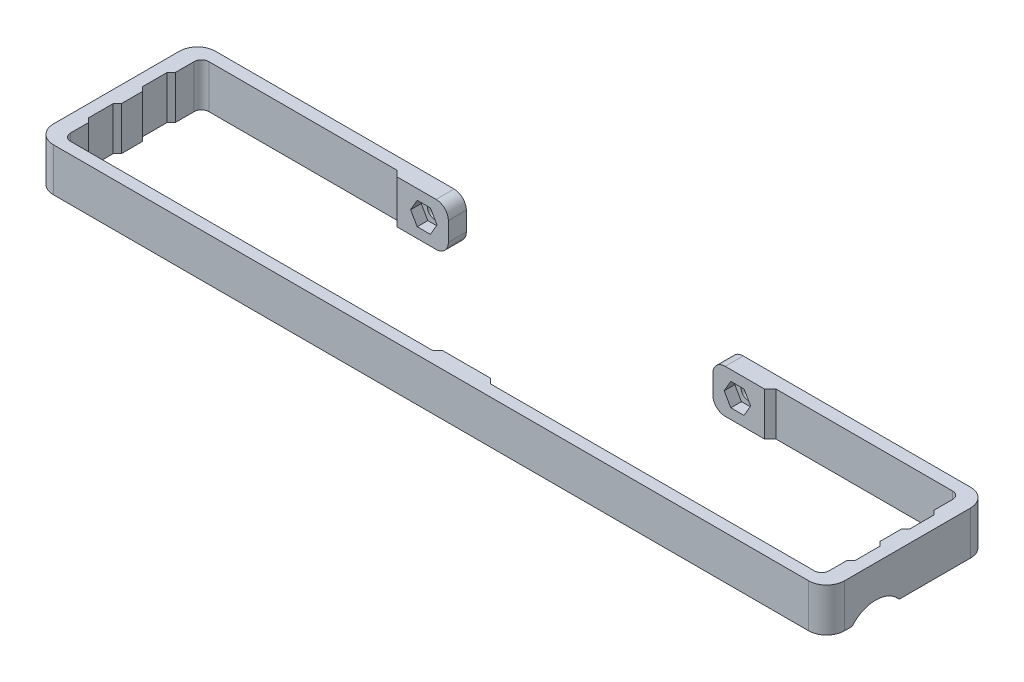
SolidWorks part; units mm, degrees
ref_plane "Front Plane" through (0, 0, 0) normal (0, 0, 1) x (1, 0, 0)
ref_plane "Top Plane" through (0, 0, 0) normal (0, 1, 0) x (1, 0, 0)
ref_plane "Right Plane" through (0, 0, 0) normal (1, 0, 0) x (0, 0, -1)
sketch "Sketch1" plane through (0, 0, 0) normal (0, 0, 1) x (1, 0, 0)
  line L1 (-72.0026, 47.8166) -> (121.3974, 47.8166)
  line L2 (-72.0026, 47.8166) -> (-72.0026, 37.2166)
  line L3 (-72.0026, 37.2166) -> (121.3974, 37.2166)
  line L4 (121.3974, 47.8166) -> (121.3974, 37.2166)
  dimension "D1" = 193.4
  dimension "D2" = 10.6
extrude "Boss-Extrude1" add sketch "Sketch1" along normal blind 4
ref_plane "Plane1" through (0, 0, 0) normal (0, 0, -1) x (-1, 0, 0)
sketch "Sketch2" plane through (0, 0, 0) normal (0, 0, -1) x (-1, 0, 0)
  line L0 (-121.3974, 47.8166) -> (72.0026, 47.8166) construction
  line L1 (-121.3974, 37.2166) -> (-117.3974, 37.2166)
  line L2 (-121.3974, 37.2166) -> (-121.3974, 47.8166)
  line L3 (-121.3974, 47.8166) -> (-117.3974, 47.8166)
  line L4 (-117.3974, 37.2166) -> (-117.3974, 47.8166)
  line L6 (72.0026, 37.2166) -> (68.0026, 37.2166)
  line L7 (72.0026, 37.2166) -> (72.0026, 47.8166)
  line L8 (72.0026, 47.8166) -> (68.0026, 47.8166)
  line L9 (68.0026, 37.2166) -> (68.0026, 47.8166)
  dimension "D1" = 4
  dimension "D2" = 4
extrude "Boss-Extrude2" add sketch "Sketch2" along normal blind 35.6
ref_plane "Plane2" through (0, 47.8166, 0) normal (0, 1, 0) x (1, 0, 0)
sketch "Sketch3" plane through (0, 47.8166, 0) normal (0, 1, 0) x (1, 0, 0)
  line L1 (-68.0026, 35.6) -> (-6.2626, 35.6)
  line L2 (-68.0026, 35.6) -> (-68.0026, 31.2)
  line L3 (-68.0026, 31.2) -> (-6.2626, 31.2)
  line L4 (-6.2626, 35.6) -> (-6.2626, 31.2)
  line L5 (117.3974, 35.6) -> (58.3974, 35.6)
  line L6 (117.3974, 35.6) -> (117.3974, 31.2)
  line L7 (117.3974, 31.2) -> (58.3974, 31.2)
  line L8 (58.3974, 35.6) -> (58.3974, 31.2)
  dimension "D1" = 4.4
  dimension "D2" = 4.4
  dimension "D3" = 61.74
  dimension "D4" = 59
extrude "Boss-Extrude3" add sketch "Sketch3" against normal blind 10.6
fillet "Fillet1" radius 4.4 4 edges at (121.3974, 42.5166, -35.6) (-72.0026, 42.5166, -35.6) (-72.0026, 42.5166, 4) (121.3974, 42.5166, 4)
ref_plane "Plane3" through (0, 0, -35.6) normal (0, 0, -1) x (-1, 0, 0)
sketch "Sketch4" plane through (0, 0, -35.6) normal (0, 0, -1) x (-1, 0, 0)
  line L0 (6.2626, 37.2166) -> (6.2626, 47.8166) construction
  line L1 (67.6026, 47.8166) -> (6.2626, 47.8166) construction
  line L2 (-58.3974, 47.8166) -> (-116.9974, 47.8166) construction
  line L3 (-58.3974, 37.2166) -> (-58.3974, 47.8166) construction
  circle A0 centre (12.2626, 42.5166) radius 1.7
  circle A1 centre (-64.3974, 42.5166) radius 1.7
  dimension "D1" = 3.4
  dimension "D2" = 3.4
  dimension "D3" = 6
  dimension "D4" = 5.3
  dimension "D5" = 5.3
  dimension "D6" = 6
extrude "Cut-Extrude1" cut sketch "Sketch4" against normal blind 10.6
ref_plane "Plane4" through (0, 0, -31.2) normal (0, 0, 1) x (1, 0, 0)
sketch "Sketch5" plane through (0, 0, -31.2) normal (0, 0, 1) x (1, 0, 0)
  line L1 (-10.646, 39.7166) -> (-9.0295, 42.5166)
  line L2 (-9.0295, 42.5166) -> (-10.646, 45.3166)
  line L3 (-10.646, 45.3166) -> (-13.8792, 45.3166)
  line L4 (-13.8792, 45.3166) -> (-15.4958, 42.5166)
  line L5 (-15.4958, 42.5166) -> (-13.8792, 39.7166)
  line L6 (-13.8792, 39.7166) -> (-10.646, 39.7166)
  line L7 (66.014, 39.7166) -> (67.6305, 42.5166)
  line L8 (67.6305, 42.5166) -> (66.014, 45.3166)
  line L9 (66.014, 45.3166) -> (62.7808, 45.3166)
  line L10 (62.7808, 45.3166) -> (61.1642, 42.5166)
  line L11 (61.1642, 42.5166) -> (62.7808, 39.7166)
  line L12 (62.7808, 39.7166) -> (66.014, 39.7166)
  circle A0 centre (-12.2626, 42.5166) radius 2.8 construction
  circle A1 centre (64.3974, 42.5166) radius 2.8 construction
  dimension "D1" = 5.6
  dimension "D2" = 5.6
extrude "Cut-Extrude2" cut sketch "Sketch5" against normal blind 2.6
sketch "Sketch6" plane through (0, 47.8166, 0) normal (0, 1, 0) x (1, 0, 0)
  line L0 (121.3974, 0.4) -> (121.3974, 31.2) construction
  line L1 (117.3974, 4) -> (118.3974, 4)
  line L2 (117.3974, 4) -> (117.3974, 14)
  line L3 (117.3974, 14) -> (118.3974, 14)
  line L4 (118.3974, 4) -> (118.3974, 14)
  line L5 (117.3974, 27.2) -> (118.3974, 27.2)
  line L6 (117.3974, 27.2) -> (117.3974, 17.2)
  line L7 (117.3974, 17.2) -> (118.3974, 17.2)
  line L8 (118.3974, 27.2) -> (118.3974, 17.2)
  line L9 (117.3974, 31.2) -> (117.3974, 0) construction
  line L10 (-68.0026, 4) -> (-69.0026, 4)
  line L11 (-68.0026, 4) -> (-68.0026, 14)
  line L12 (-68.0026, 14) -> (-69.0026, 14)
  line L13 (-69.0026, 4) -> (-69.0026, 14)
  line L14 (-68.0026, 27.2) -> (-69.0026, 27.2)
  line L15 (-68.0026, 27.2) -> (-68.0026, 17.2)
  line L16 (-68.0026, 17.2) -> (-69.0026, 17.2)
  line L17 (-69.0026, 27.2) -> (-69.0026, 17.2)
  line L18 (-68.0026, 31.2) -> (-68.0026, 0) construction
  line L19 (117.3974, 0) -> (-68.0026, 0) construction
  line L20 (58.3974, 31.2) -> (117.3974, 31.2) construction
  line L21 (-72.0026, 0.4) -> (-72.0026, 31.2) construction
  line L22 (-68.0026, 31.2) -> (-6.2626, 31.2) construction
  point P32 (117.8974, 4)
  dimension "D1" = 3
  dimension "D2" = 3
  dimension "D3" = 4
  dimension "D4" = 10
  dimension "D5" = 4
  dimension "D6" = 10
  dimension "D7" = 4
  dimension "D8" = 3
  dimension "D9" = 3
  dimension "D10" = 4
  dimension "D11" = 10
  dimension "D12" = 10
extrude "Cut-Extrude3" cut sketch "Sketch6" against normal blind 13.6
sketch "Sketch7" plane through (0, 47.8166, 0) normal (0, 1, 0) x (1, 0, 0)
  line L0 (116.9974, -4) -> (-67.6026, -4) construction
  line L1 (117.3974, 0) -> (34.3974, 0)
  line L2 (117.3974, 0) -> (117.3974, -1.2)
  line L3 (117.3974, -1.2) -> (34.3974, -1.2)
  line L4 (34.3974, 0) -> (34.3974, -1.2)
  line L5 (-68.0026, 0) -> (24.3974, 0)
  line L6 (-68.0026, 0) -> (-68.0026, -1.2)
  line L7 (-68.0026, -1.2) -> (24.3974, -1.2)
  line L8 (24.3974, 0) -> (24.3974, -1.2)
  line L9 (-67.6026, 35.6) -> (-6.2626, 35.6) construction
  line L10 (117.3974, 31.2) -> (70.3974, 31.2)
  line L11 (117.3974, 31.2) -> (117.3974, 32.6)
  line L12 (117.3974, 32.6) -> (70.3974, 32.6)
  line L13 (70.3974, 31.2) -> (70.3974, 32.6)
  line L14 (-68.0026, 31.2) -> (-18.2626, 31.2)
  line L15 (-68.0026, 31.2) -> (-68.0026, 32.6)
  line L16 (-68.0026, 32.6) -> (-18.2626, 32.6)
  line L17 (-18.2626, 31.2) -> (-18.2626, 32.6)
  line L18 (58.3974, 35.6) -> (116.9974, 35.6) construction
  line L19 (58.3974, 35.6) -> (58.3974, 31.2) construction
  line L20 (-6.2626, 31.2) -> (-6.2626, 35.6) construction
  point P26 (70.3974, 31.9)
  point P31 (-6.2626, 33.4)
  dimension "D1" = 10
  dimension "D2" = 83
  dimension "D3" = 2.8
  dimension "D4" = 2.8
  dimension "D5" = 3
  dimension "D6" = 3
  dimension "D7" = 12
  dimension "D8" = 12
extrude "Cut-Extrude4" cut sketch "Sketch7" against normal blind 13.6
chamfer "Chamfer1" distance 2 angle 45 12 edges at (70.3974, 42.5166, -32.6) (-18.2626, 42.5166, -32.6) (118.3974, 42.5166, -27.2) (118.3974, 42.5166, -4) (118.3974, 42.5166, -14) (118.3974, 42.5166, -17.2) (34.3974, 42.5166, 1.2) (24.3974, 42.5166, 1.2) (-69.0026, 42.5166, -14) (-69.0026, 42.5166, -4) (-69.0026, 42.5166, -17.2) (-69.0026, 42.5166, -27.2)
fillet "Fillet2" radius 1.8 4 edges at (117.3974, 42.5166, -32.6) (117.3974, 42.5166, 1.2) (-68.0026, 42.5166, -32.6) (-68.0026, 42.5166, 1.2)
fillet "Fillet3" radius 3 4 edges at (-6.2626, 47.8166, -33.4) (-6.2626, 37.2166, -33.4) (58.3974, 47.8166, -33.4) (58.3974, 37.2166, -33.4)
ref_plane "Plane5" through (121.3974, 0, 0) normal (1, 0, 0) x (0, 0, -1)
ref_plane "Plane6" through (0, 0, 1.2) normal (0, 0, -1) x (-1, 0, 0)
sketch "Sketch9" plane through (0, 0, 1.2) normal (0, 0, -1) x (-1, 0, 0)
  line L0 (-96.9974, 40.8166) -> (-66.9974, 40.8166) construction
  line L1 (-116.9974, 37.2166) -> (-61.3974, 37.2166) construction
  line L2 (-116.9974, 47.8166) -> (-116.9974, 37.2166) construction
  text T0 "ROYAL EX P2" font "Century Gothic" height 3.5
  dimension "D1" = 3.6
  dimension "D2" = 20
  dimension "D3" = 30
extrude "Cut-Extrude6" cut sketch "Sketch9" against normal blind 0.6
sketch "Sketch10" plane through (121.3974, 0, 0) normal (1, 0, 0) x (0, 0, -1)
  line L0 (0.4, 47.8166) -> (31.2, 47.8166) construction
  line L1 (0.4, 47.8166) -> (0.4, 37.2166) construction
  circle A0 centre (8, 32.4166) radius 7.5
  point P3 (0, 0)
  dimension "D1" = 15
  dimension "D2" = 15.4
  dimension "D3" = 7.6
extrude "Cut-Extrude7" cut sketch "Sketch10" against normal blind 10
